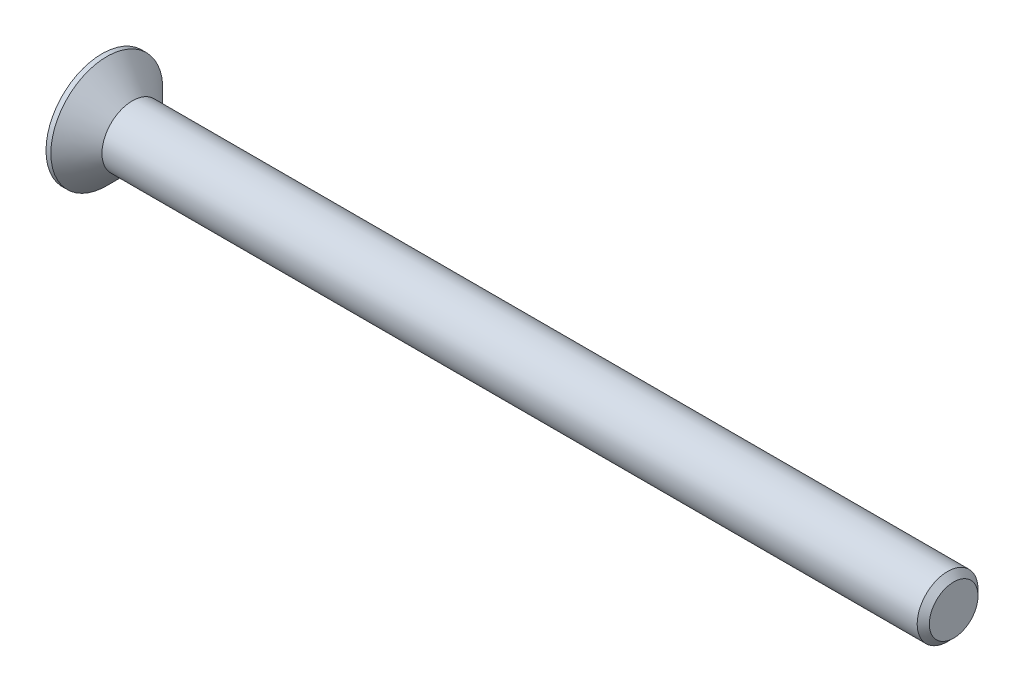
SolidWorks part; units mm, degrees
ref_plane "Front Plane" through (0, 0, 0) normal (0, 0, 1) x (1, 0, 0)
ref_plane "Top Plane" through (0, 0, 0) normal (0, 1, 0) x (1, 0, 0)
ref_plane "Right Plane" through (0, 0, 0) normal (1, 0, 0) x (0, 0, -1)
sketch "Sketch1" plane through (0, 0, 0) normal (0, 0, 1) x (1, 0, 0)
  line L1 (-2.5, 4.6) -> (-2.5, 0)
  line L2 (-2.5, 0) -> (67.5, 0)
  line L3 (67.5, 0) -> (67.5, 2.5)
  line L4 (67.5, 2.5) -> (0, 2.5)
  line L5 (-2.5, 4.6) -> (-2.1, 4.6)
  line L6 (-2.1, 4.6) -> (0, 2.5)
  dimension "D1" = 2.5
  dimension "D2" = 45
  dimension "D3" = 2.5
  dimension "D4" = 70
  dimension "D5" = 4.6
revolve "Revolve1" add sketch "Sketch1" angle 360 about L2
chamfer "Chamfer1" distance 0.5 angle 45 1 edges at (67.5, 0, 2.5)
sketch "Sketch2" plane through (-2.5, 0, 0) normal (-1, 0, 0) x (0, 0, 1)
  line L0 (-0.575, 2.3) -> (0.575, 2.3)
  line L1 (0.575, 2.3) -> (0.575, 0.575)
  line L2 (0.575, 0.575) -> (2.3, 0.575)
  line L3 (2.3, 0.575) -> (2.3, -0.575)
  line L4 (2.3, -0.575) -> (0.575, -0.575)
  line L5 (0.575, -0.575) -> (0.575, -2.3)
  line L6 (0.575, -2.3) -> (-0.575, -2.3)
  line L7 (-0.575, -2.3) -> (-0.575, -0.575)
  line L8 (-0.575, -0.575) -> (-2.3, -0.575)
  line L9 (-2.3, -0.575) -> (-2.3, 0.575)
  line L10 (-2.3, 0.575) -> (-0.575, 0.575)
  line L11 (-0.575, 0.575) -> (-0.575, 2.3)
  point P2 (0, 2.3)
  point P14 (0, -2.3)
  point P15 (2.3, 0)
  point P16 (-2.3, 0)
  dimension "D1" = 4.6
  dimension "D2" = 1.15
extrude "Cut-Extrude1" cut sketch "Sketch2" against normal blind 2.1
